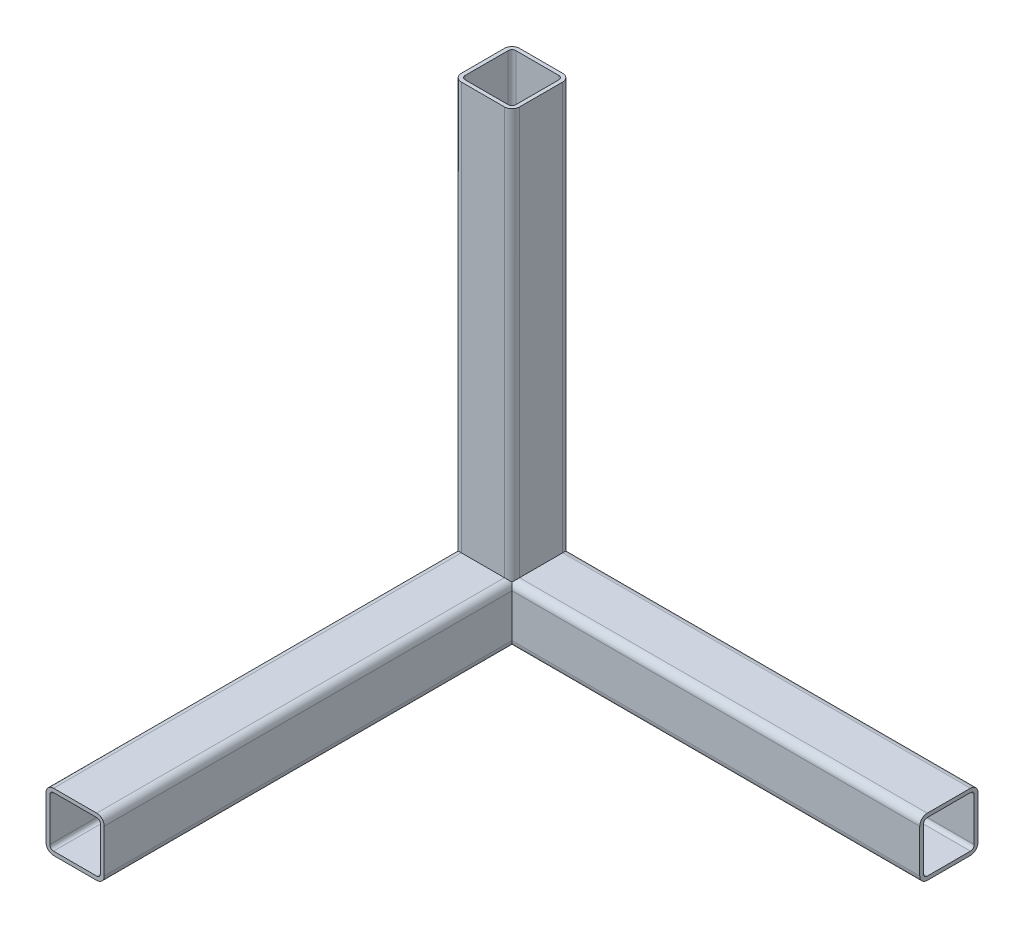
SolidWorks part; units mm, degrees
ref_plane "Front Plane" through (0, 0, 0) normal (0, 0, 1) x (1, 0, 0)
ref_plane "Top Plane" through (0, 0, 0) normal (0, 1, 0) x (1, 0, 0)
ref_plane "Right Plane" through (0, 0, 0) normal (1, 0, 0) x (0, 0, -1)
sketch3d "3DSketch1"
  line L0 (0, 0, 0) -> (300, 0, 0)
  line L1 (0, 0, 0) -> (0, 0, 300)
  line L2 (0, 0, 0) -> (0, 300, 0)
  dimension "D1" = 300
other "Structural Member1"
ref_plane "Plane1" through (0, 0, 0) normal (1, 0, 0) x (0, 0, -1)
sketch "Sketch11" plane through (0, 0, 0) normal (1, 0, 0) x (0, 0, -1)
  line L0 (-14.8, -17.4) -> (14.8, -17.4)
  line L1 (-17.4, -14.8) -> (-17.4, 14.8)
  line L2 (14.8, 17.4) -> (-14.8, 17.4)
  line L3 (17.4, 14.8) -> (17.4, -14.8)
  line L4 (-14.8, -20) -> (14.8, -20)
  line L5 (-20, -14.8) -> (-20, 14.8)
  line L6 (14.8, 20) -> (-14.8, 20)
  line L7 (20, 14.8) -> (20, -14.8)
  line L8 (-20, 0) -> (-17.4, 0) construction
  line L9 (-17.4, 0) -> (17.4, 0) construction
  line L10 (17.4, 0) -> (20, 0) construction
  line L12 (0, 20) -> (0, 17.4) construction
  line L13 (0, 17.4) -> (0, -17.4) construction
  line L14 (0, -17.4) -> (0, -20) construction
  arc A0 (20, 14.8) -> (14.8, 20) centre (14.8, 14.8) ccw
  arc A1 (14.8, -20) -> (20, -14.8) centre (14.8, -14.8) ccw
  arc A2 (-20, -14.8) -> (-14.8, -20) centre (-14.8, -14.8) ccw
  arc A3 (-14.8, 20) -> (-20, 14.8) centre (-14.8, 14.8) ccw
  arc A4 (-14.8, 17.4) -> (-17.4, 14.8) centre (-14.8, 14.8) ccw
  arc A5 (17.4, 14.8) -> (14.8, 17.4) centre (14.8, 14.8) ccw
  arc A6 (14.8, -17.4) -> (17.4, -14.8) centre (14.8, -14.8) ccw
  arc A7 (-17.4, -14.8) -> (-14.8, -17.4) centre (-14.8, -14.8) ccw
  point P2 (-20, 20)
  point P33 (-20, -20)
  point P34 (20, -20)
  point P36 (20, 20)
  point P37 (0, 0)
  point P38 (0, 0)
  dimension "D1" = 5.2
  dimension "Thickness" = 2.6
  dimension "V_leg" = 40
  dimension "H_leg" = 40
